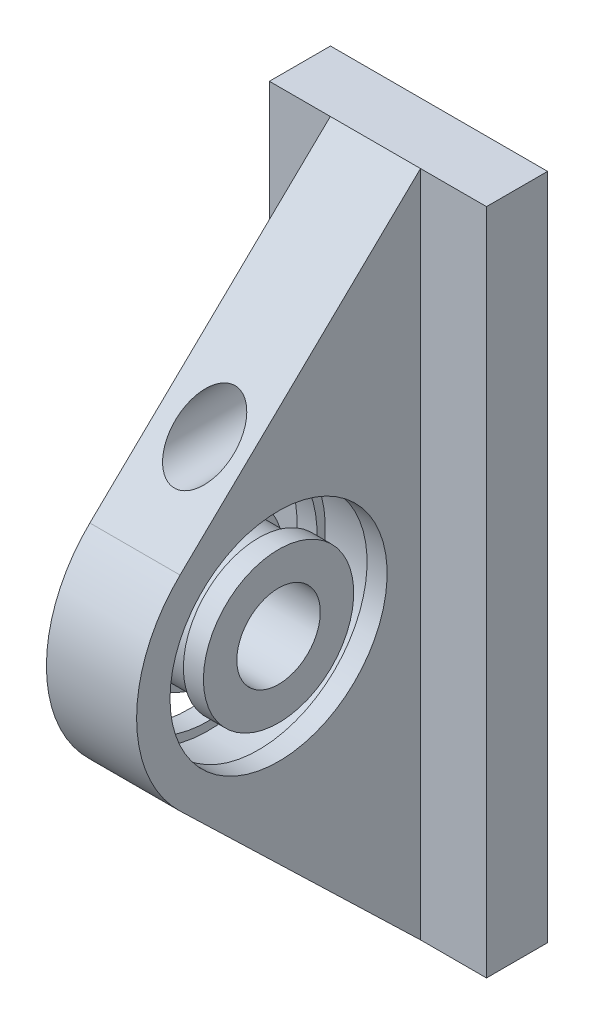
SolidWorks part; units mm, degrees
ref_plane "Front Plane" through (0, 0, 0) normal (0, 0, 1) x (1, 0, 0)
ref_plane "Top Plane" through (0, 0, 0) normal (0, 1, 0) x (1, 0, 0)
ref_plane "Right Plane" through (0, 0, 0) normal (1, 0, 0) x (0, 0, -1)
sketch "Sketch1" plane through (0, 0, 0) normal (0, 0, 1) x (1, 0, 0)
  line L0 (19.238, 8.4901) -> (19.238, 10.4901)
  line L1 (19.238, 10.4901) -> (24.638, 10.4901)
  line L2 (24.638, 10.4901) -> (24.638, 8.4901)
  line L3 (19.238, 8.4901) -> (20.438, 8.4901)
  line L4 (24.638, 8.4901) -> (23.438, 8.4901)
  line L5 (17.1856, 1.9901) -> (27.1181, 1.9901) construction
  line L6 (19.238, 4.4901) -> (24.638, 4.4901)
  line L7 (20.438, 8.4901) -> (20.438, 8.9901)
  line L8 (20.438, 8.9901) -> (23.438, 8.9901)
  line L9 (23.438, 8.4901) -> (23.438, 8.9901)
  line L10 (24.638, 4.4901) -> (24.638, 6.4901)
  line L11 (19.238, 4.4901) -> (19.238, 6.4901)
  line L12 (19.238, 6.4901) -> (20.438, 6.4901)
  line L13 (24.638, 6.4901) -> (23.438, 6.4901)
  line L14 (20.438, 6.4901) -> (20.438, 5.9901)
  line L15 (23.438, 6.4901) -> (23.438, 5.9901)
  line L16 (20.438, 5.9901) -> (23.438, 5.9901)
  dimension "D1" = 1.5
  dimension "D2" = 3
  dimension "D3" = 1.2
  dimension "D4" = 3
  dimension "D5" = 1.2
  dimension "D6" = 6.5
  dimension "D7" = 1.5
  dimension "D8" = 0.5
  dimension "D9" = 0.5
revolve "Revolve1" add sketch "Sketch1" angle 360 about L5
sketch "Sketch4" plane through (24.638, 0, 0) normal (1, 0, 0) x (0, 0, -1)
  line L0 (0, 1.9901) -> (17.0454, 1.9901) construction
  line L1 (8.5, 21.9901) -> (12.1579, 21.9901)
  line L2 (8.5, 21.9901) -> (8.5, -18.0099)
  line L3 (8.5, -18.0099) -> (12.1579, -18.0099)
  line L4 (12.1579, 21.9901) -> (12.1579, -18.0099)
  dimension "D1" = 20
  dimension "D2" = 20
extrude "Boss-Extrude2" add sketch "Sketch4" against normal blind 9.05 and the other way blind 3.95 separate body
ref_plane "Plane2" through (21.938, 0, 0) normal (-1, 0, 0) x (0, 0, 1)
sketch "Sketch6" plane through (21.938, 0, 0) normal (-1, 0, 0) x (0, 0, 1)
  line L0 (-8.5, -18.0099) -> (5.8991, -4.1295)
  line L1 (-8.5, 21.9901) -> (-8.5, -18.0099) construction
  line L2 (-8.5, 1.9901) -> (-8.5, -18.0099)
  circle A0 centre (0, 1.9901) radius 8.5 construction
  arc A1 (5.8991, -4.1295) -> (-8.5, 1.9901) centre (0, 1.9901) cw
extrude "Boss-Extrude3" add sketch "Sketch6" along normal mid plane 5.4
ref_plane "Plane3" through (0, 1.9901, 0) normal (0, 1, 0) x (-1, 0, 0)
mirror "Mirror1" about plane through (0, 1.9901, 0) normal (0, 1, 0) of "Boss-Extrude3"
sketch "Sketch7" plane through (0, 0, -12.1579) normal (0, 0, -1) x (-1, 0, 0)
  line L0 (-28.588, 21.9901) -> (-15.588, 21.9901) construction
  line L1 (-28.588, -18.0099) -> (-28.588, 21.9901) construction
  circle A0 centre (-22.088, 11.9901) radius 1.75
  circle A1 centre (-22.088, -8.0099) radius 1.75
  dimension "D2" = 3.5
  dimension "D3" = 3.5
  dimension "D1" = 20
  dimension "D4" = 10
  dimension "D5" = 6.5
  dimension "D6" = 6.5
extrude "Cut-Extrude1" cut sketch "Sketch7" against normal blind 25.4
